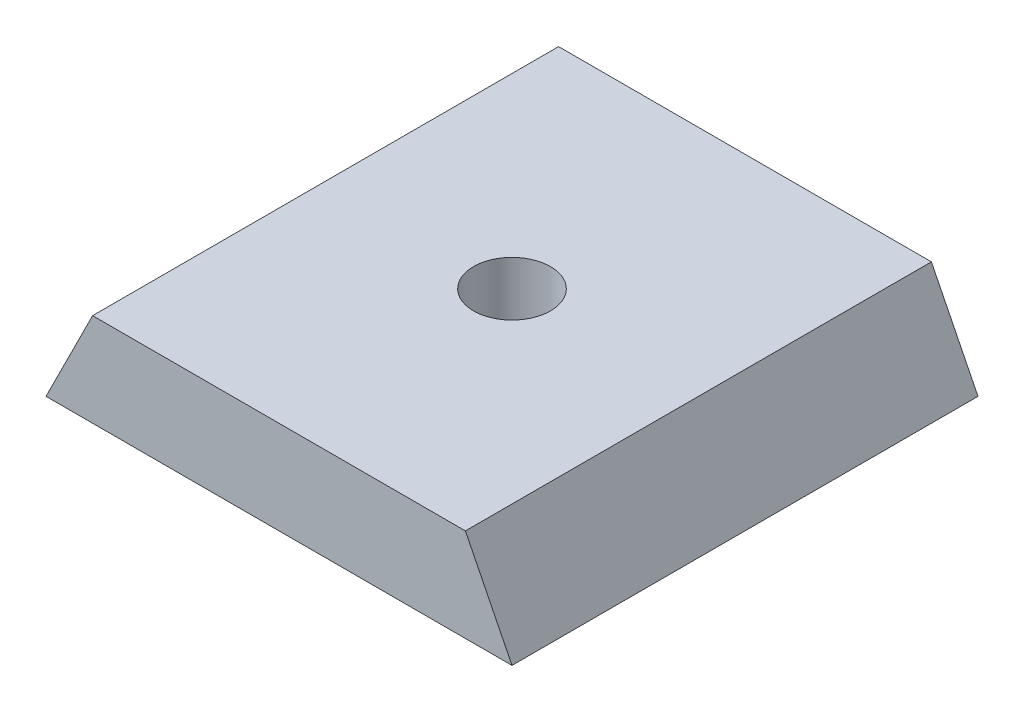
SolidWorks part; units mm, degrees
ref_plane "Front Plane" through (0, 0, 0) normal (0, 0, 1) x (1, 0, 0)
ref_plane "Top Plane" through (0, 0, 0) normal (0, 1, 0) x (1, 0, 0)
ref_plane "Right Plane" through (0, 0, 0) normal (1, 0, 0) x (0, 0, -1)
sketch "Sketch1" plane through (0, 0, 0) normal (0, 1, 0) x (1, 0, 0)
  line L1 (0, 0) -> (20, 0)
  line L2 (0, 0) -> (0, 20)
  line L3 (0, 20) -> (20, 20)
  line L4 (20, 0) -> (20, 20)
  dimension "D1" = 20
  dimension "D2" = 20
extrude "Extrude1" add sketch "Sketch1" along normal blind 4
chamfer "Chamfer1" distance 4 distance2 2 2 edges at (0, 4, -10) (20, 4, -10)
sketch "Sketch2" plane through (0, 4, 0) normal (0, 1, 0) x (1, 0, 0)
  line L1 (18, 20) -> (2, 20) construction
  line L2 (2, 20) -> (2, 0) construction
  point P4 (10, 10)
  dimension "D1" = 10
  dimension "D2" = 8
hole_wizard "M4 Tapped Hole1" positions "3DSketch3" profile "Sketch6" tap size "M4" standard "ISO"
sketch3d "3DSketch3"
  point P0 (10, 4, -10)
sketch "Sketch6" plane through (10, 4, -10) normal (1, 0, 0) x (0, 0, 1)
  line L0 (0, 0) -> (0, 4)
  line L1 (0, 4) -> (1.65, 4)
  line L2 (1.65, 4) -> (1.65, 0)
  line L5 (1.65, 0) -> (0, 0)
  line L11 (0, -6.35) -> (0, 107.95) construction
  dimension "Thru Tap Drill Dia." = 3.3
  dimension "Thru Tap Drill Depth" = 4
